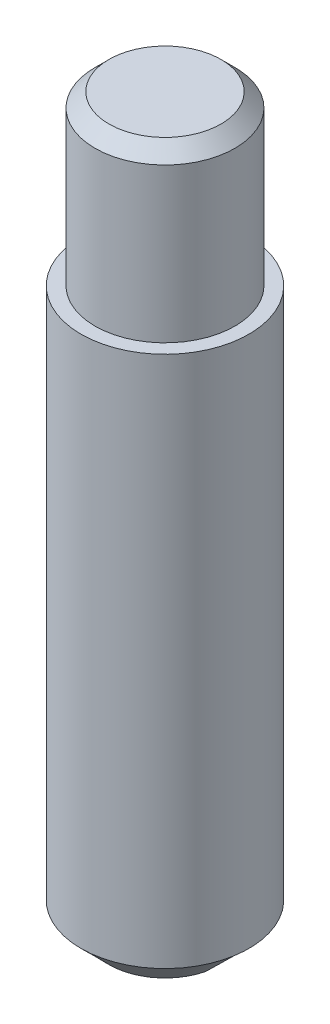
SolidWorks part; units mm, degrees
ref_plane "Front Plane" through (0, 0, 0) normal (0, 0, 1) x (1, 0, 0)
ref_plane "Top Plane" through (0, 0, 0) normal (0, 1, 0) x (1, 0, 0)
ref_plane "Right Plane" through (0, 0, 0) normal (1, 0, 0) x (0, 0, -1)
sketch "Sketch1" plane through (0, 0, 0) normal (0, 1, 0) x (1, 0, 0)
  circle A0 centre (0, 0) radius 3
  dimension "D1" = 6
extrude "Extrude1" add sketch "Sketch1" along normal blind 26
sketch "Sketch2" plane through (0, 26, 0) normal (0, 1, 0) x (1, 0, 0)
  circle A0 centre (0, 0) radius 2.5
  circle A1 centre (0, 0) radius 6.8816
  dimension "D1" = 5
extrude "Extrude2" cut sketch "Sketch2" against normal blind 6
chamfer "Chamfer1" distance 0.5 angle 45 1 edges at (0, 26, 2.5)
chamfer "Chamfer2" distance 1 angle 45 1 edges at (0, 0, 3)
sketch "Sketch3" plane through (0, 0, 0) normal (0, -1, 0) x (1, 0, 0)
  line L0 (-2, 0) -> (2, 0) construction
  line L1 (-4.086, -0.5) -> (4.1444, -0.5)
  line L2 (-4.0082, 0.5) -> (4.2222, 0.5)
  line L3 (-2, 0.5) -> (2, 0.5) construction
  line L4 (-2, -0.5) -> (2, -0.5) construction
  line L5 (4.2222, 0.5) -> (4.1444, -0.5)
  line L6 (-4.0082, 0.5) -> (-4.086, -0.5)
  circle A0 centre (0, 0) radius 2 construction
  dimension "D1" = 0.5
  dimension "D2" = 0.5
extrude "Extrude3" cut sketch "Sketch3" against normal blind 1
